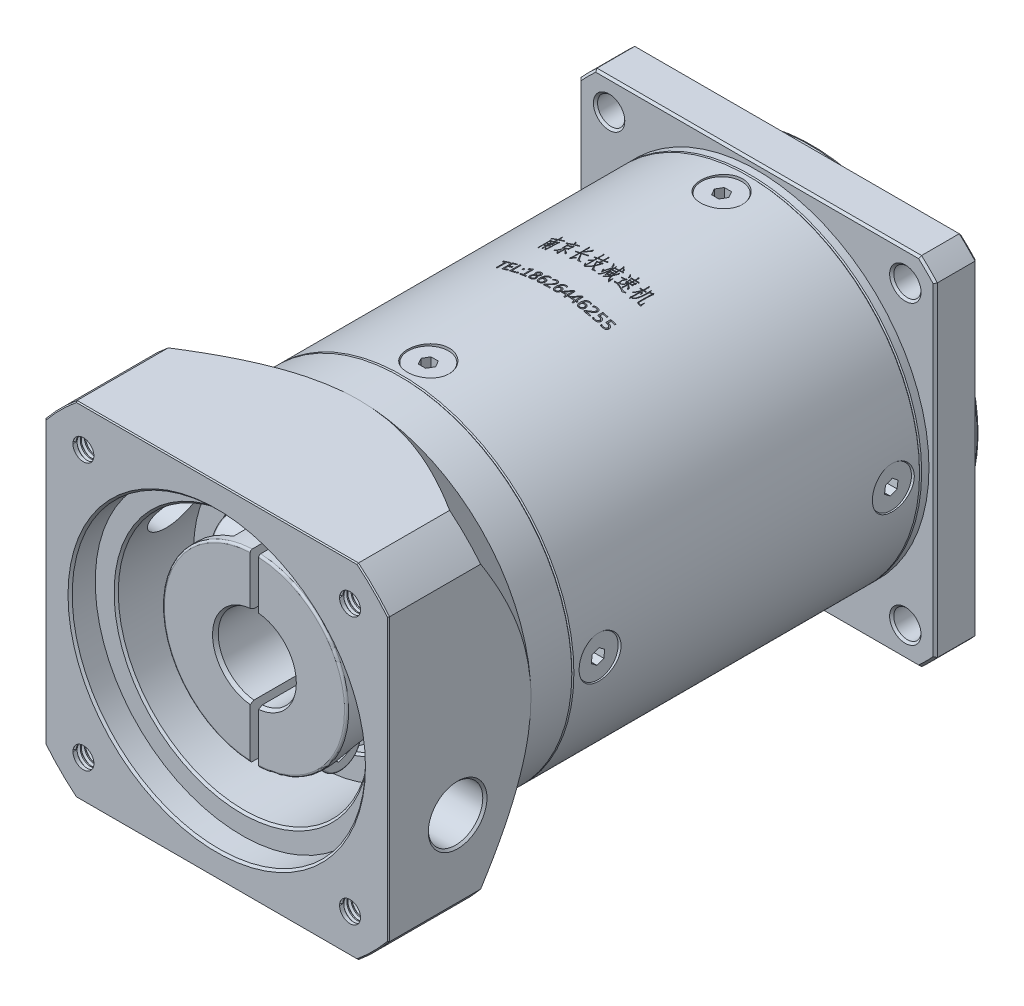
SolidWorks part; units mm, degrees
ref_plane "前视基准面" through (0, 0, 0) normal (0, 0, 1) x (1, 0, 0)
ref_plane "上视基准面" through (0, 0, 0) normal (0, 1, 0) x (1, 0, 0)
ref_plane "右视基准面" through (0, 0, 0) normal (1, 0, 0) x (0, 0, -1)
imported_body "19-70-90-M6-1-solid1"
imported_body "19-70-90-M6-1-solid2"
imported_body "19-70-90-M6-1-solid3"
imported_body "19-70-90-M6-1-solid4"
imported_body "ZF80-K15-L3-5-solid1"
imported_body "ZF80-K15-L3-5-solid2"
imported_body "ZF80-K15-L3-5-solid3"
imported_body "ZF80-K15-L3-5-solid4"
imported_body "ZF80-K15-L3-5-solid5"
imported_body "ZF80-K15-L3-5-solid6"
imported_body "ZF80-K15-L3-5-solid7"
imported_body "ZF80-K15-L3-5-solid8"
imported_body "ZF80-K15-L3-5-solid9"
sketch "草图1" plane through (0, 0, -63.8295) normal (0, 0, -1) x (-1, 0, 0)
  circle A0 centre (82.8321, 33.9198) radius 11.1046
  dimension "D1" = 22.2093
extrude "凸台-拉伸1" add sketch "草图1" along normal blind 5
